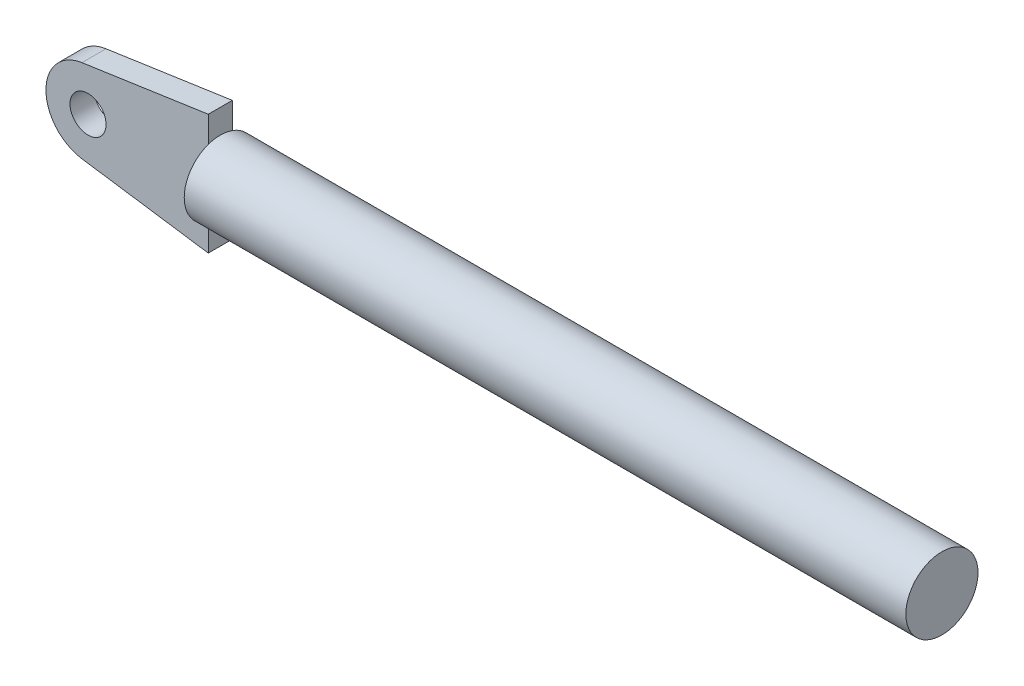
SolidWorks part; units mm, degrees
ref_plane "Front Plane" through (0, 0, 0) normal (0, 0, 1) x (1, 0, 0)
ref_plane "Top Plane" through (0, 0, 0) normal (0, 1, 0) x (1, 0, 0)
ref_plane "Right Plane" through (0, 0, 0) normal (1, 0, 0) x (0, 0, -1)
sketch "Sketch1" plane through (0, 0, 0) normal (1, 0, 0) x (0, 0, -1)
  circle A0 centre (0, 0) radius 30
  dimension "D1" = 60
extrude "Boss-Extrude1" add sketch "Sketch1" along normal blind 600
sketch "Sketch3" plane through (0, 0, 0) normal (0, 0, 1) x (1, 0, 0)
  line L0 (0, -50) -> (0, 50)
  line L1 (0, 30) -> (0, -30) construction
  line L2 (0, 50) -> (-105.0657, 34.6315)
  line L3 (0, 0) -> (-100, 0) construction
  line L4 (0, -50) -> (-105.0657, -34.6315)
  arc A0 (-105.0657, 34.6315) -> (-105.0657, -34.6315) centre (-100, 0) ccw
  circle A1 centre (-100, 0) radius 15
  dimension "D3" = 35
  dimension "D4" = 30
  dimension "D1" = 100
  dimension "D2" = 100
extrude "Boss-Extrude2" add sketch "Sketch3" along normal mid plane 20
